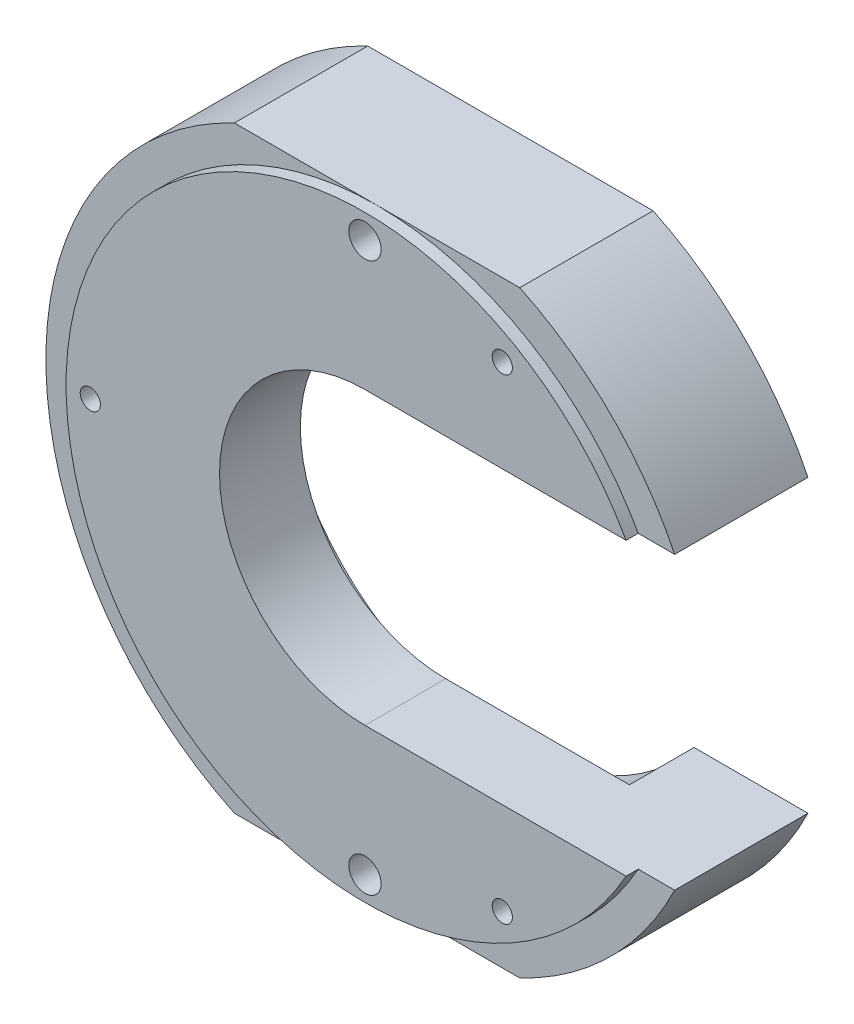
SolidWorks part; units mm, degrees
ref_plane "前视基准面" through (0, 0, 0) normal (0, 0, 1) x (1, 0, 0)
ref_plane "上视基准面" through (0, 0, 0) normal (0, 1, 0) x (1, 0, 0)
ref_plane "右视基准面" through (0, 0, 0) normal (1, 0, 0) x (0, 0, -1)
other "Configuration Table"
sketch "草图1" plane through (0, 0, 0) normal (0, 0, 1) x (1, 0, 0)
  line L0 (75.3999, 0) -> (-89.7999, 0) construction
  line L1 (0, 45.5694) -> (0, -52.8304) construction
  line L2 (-60.1999, 37) -> (73.5999, 37) construction
  line L3 (73.5999, -37) -> (-83.5999, -37) construction
  line L4 (-17.6635, 37) -> (17.6635, 37)
  line L5 (-17.6635, -37) -> (17.6635, -37)
  line L6 (36.8375, 18) -> (0, 18)
  line L7 (36.8375, -18) -> (0, -18)
  arc A0 (-17.6635, 37) -> (-17.6635, -37) centre (0, 0) ccw
  arc A1 (17.6635, -37) -> (36.8375, -18) centre (0, 0) ccw
  arc A2 (36.8375, 18) -> (17.6635, 37) centre (0, 0) ccw
  arc A3 (0, 18) -> (0, -18) centre (0, 0) ccw
  circle A4 centre (0, 0) radius 35 construction
  dimension "D1" = 82
  dimension "D6" = 70
  dimension "D2" = 37
  dimension "D3" = 37
  dimension "D4" = 18
  dimension "D5" = 18
extrude "凸台-拉伸1" add sketch "草图1" along normal blind 16.5
sketch "草图2" plane through (0, 0, 16.5) normal (0, 0, 1) x (1, 0, 0)
  line L1 (17.6635, 37) -> (-17.6635, 37) construction
  line L3 (-17.6635, -37) -> (17.6635, -37) construction
  line L4 (32.3265, 18) -> (0, 18) construction
  line L5 (0, 18) -> (36.8375, 18) construction
  line L6 (0, 18) -> (0, -18) construction
  line L7 (0, -18) -> (32.3265, -18) construction
  line L8 (36.8375, -18) -> (0, -18) construction
  line L9 (32.3265, 18) -> (0, 18)
  line L10 (0, -18) -> (32.3265, -18)
  arc A0 (0, 37) -> (0, -37) centre (0, 0) ccw
  arc A1 (0, -37) -> (32.3265, -18) centre (0, 0) ccw
  arc A2 (32.3265, 18) -> (0, 37) centre (0, 0) ccw
  arc A3 (0, 18) -> (0, -18) centre (0, 0) ccw
  dimension "D1" = 74
sketch "草图3" plane through (0, 0, 0) normal (0, 0, -1) x (-1, 0, 0)
  line L1 (-22.7376, 18) -> (0, 18)
  line L3 (0, 18) -> (-36.8375, 18) construction
  line L4 (0, -18) -> (-22.7376, -18)
  arc A0 (-22.7376, -18) -> (-22.7376, 18) centre (0, 0) ccw
  arc A1 (0, -18) -> (0, 18) centre (0, 0) ccw
  dimension "D1" = 58
  dimension "D2" = 18
extrude "切除-拉伸1" cut sketch "草图3" against normal blind 8 contours L1 A1 L4 A0
sketch "草图5" plane through (0, 0, 0) normal (0, 0, -1) x (-1, 0, 0)
  line L0 (0, 0) -> (46.4526, 0) construction
  line L1 (0, 29) -> (0, -29) construction
  line L2 (0, 0) -> (-17, -29.4449) construction
  line L3 (0, 0) -> (-17, 29.4449) construction
  arc A0 (-22.7376, -18) -> (-22.7376, 18) centre (0, 0) ccw construction
  arc A1 (-22.7376, -18) -> (-22.7376, 18) centre (0, 0) ccw construction
  circle A2 centre (0, 0) radius 34 construction
  circle A3 centre (0, 34) radius 2.95
  circle A4 centre (0, -34) radius 2.95
  dimension "D1" = 68
  dimension "D2" = 5.9
  dimension "D3" = 30
extrude "凸台-拉伸3" add sketch "草图2" along normal blind 1.5
extrude "切除-拉伸6" cut sketch "草图5" against normal blind 4
hole_wizard "M3 螺纹孔1" positions "草图9" profile "草图10" tap size "M3" standard "GB"
sketch "草图9" plane through (0, 0, 0) normal (0, 0, -1) x (-1, 0, 0)
  line L0 (0, 0) -> (46.4526, 0) construction
  circle A0 centre (0, 0) radius 34 construction
  point P0 (-17, 29.4449)
  point P3 (-17, -29.4449)
  point P6 (34, 0)
sketch "草图10" plane through (17, 29.4449, 0) normal (1, 0, 0) x (0, 1, 0)
  line L0 (0, 0) -> (0, 18)
  line L1 (0, 18) -> (1.25, 18)
  line L2 (1.25, 18) -> (1.25, 0.275)
  line L3 (1.25, 0.275) -> (1.525, 0)
  line L5 (1.525, 0) -> (0, 0)
  line L6 (-1.25, 0.275) -> (-1.525, 0) construction
  line L11 (0, -6.35) -> (0, 107.95) construction
  dimension "通孔螺纹孔钻头直径" = 2.5
  dimension "通孔螺纹孔钻头深度" = 18
  dimension "近端锥形沉头孔直径" = 3.05
  dimension "近端锥形沉头孔角度" = 90
hole_wizard "Ø4.0mm 暗销孔1" positions "草图13" profile "草图14" hole size "Ø4.0" standard "GB"
sketch "草图13" plane through (0, 0, 4) normal (0, 0, -1) x (-1, 0, 0)
  point P0 (0, 34)
  point P3 (0, -34)
sketch "草图14" plane through (0, 34, 4) normal (1, 0, 0) x (0, 1, 0)
  line L0 (0, 0) -> (0, 14)
  line L1 (0, 14) -> (2, 14)
  line L2 (2, 14) -> (2, 0.025)
  line L3 (2, 0.025) -> (2.025, 0)
  line L5 (2.025, 0) -> (0, 0)
  line L6 (-2, 0.025) -> (-2.025, 0) construction
  line L11 (0, -6.35) -> (0, 107.95) construction
  dimension "通孔孔直径" = 4
  dimension "通孔孔深度" = 14
  dimension "近端锥形沉头孔直径" = 4.05
  dimension "近端锥形沉头孔角度" = 90
